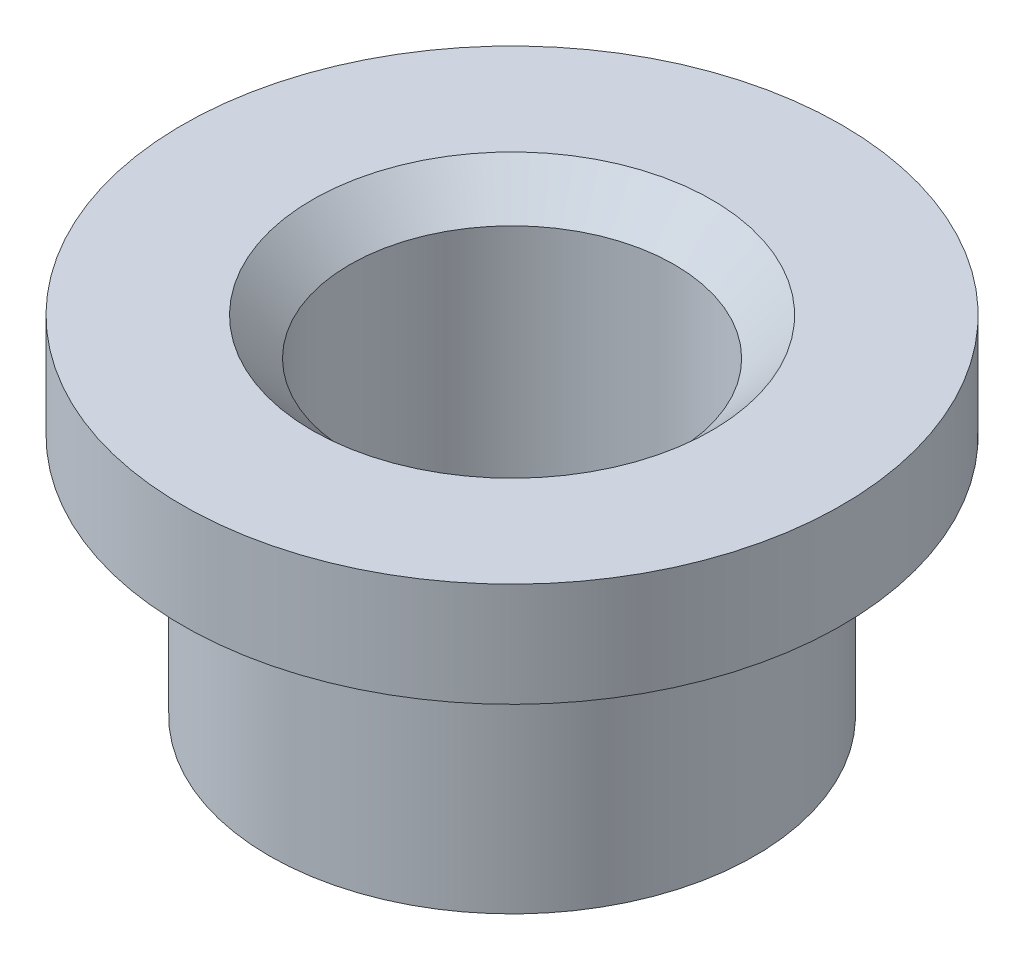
SolidWorks part; units mm, degrees
ref_plane "Front Plane" through (0, 0, 0) normal (0, 0, 1) x (1, 0, 0)
ref_plane "Top Plane" through (0, 0, 0) normal (0, 1, 0) x (1, 0, 0)
ref_plane "Right Plane" through (0, 0, 0) normal (1, 0, 0) x (0, 0, -1)
sketch "Sketch1" plane through (0, 0, 0) normal (0, 1, 0) x (1, 0, 0)
  circle A0 centre (0, 0) radius 12.065
  point P3 (0, 0)
extrude "Boss-Extrude1" add sketch "Sketch1" along normal blind 3.81
sketch "Sketch2" plane through (0, 0, 0) normal (0, -1, 0) x (1, 0, 0)
  circle A0 centre (0, 0) radius 8.89
extrude "Boss-Extrude2" add sketch "Sketch2" along normal blind 8.89
hole_wizard "1/4-18 NPSM Tapped Hole1" positions "3DSketch1" profile "Sketch3" tap size "1/4-18 NPSM" standard "ANSI Inch"
sketch3d "3DSketch1"
  point P0 (0, 0, 0)
  point P3 (0, 3.81, 0)
  point P6 (0, 0, 0)
  point P8 (0, 3.81, 0)
  point P10 (0, 3.81, 0)
  point P12 (0, 3.81, 0)
  point P13 (0.0126, 3.81, -0.019)
sketch "Sketch3" plane through (0, 3.81, 0) normal (1, 0, 0) x (0, 0, 1)
  line L0 (0, 0) -> (0, 12.7)
  line L1 (0, 12.7) -> (5.9436, 12.7)
  line L2 (5.9436, 12.7) -> (5.9436, 1.3716)
  line L3 (5.9436, 1.3716) -> (7.3152, 0)
  line L5 (7.3152, 0) -> (0, 0)
  line L6 (-5.9436, 1.3716) -> (-7.3152, 0) construction
  line L11 (0, -6.35) -> (0, 107.95) construction
  dimension "Thru Tap Drill Dia." = 11.8872
  dimension "Thru Tap Drill Depth" = 12.7
  dimension "Near C'Sink Dia." = 14.6304
  dimension "Near C'Sink Angle" = 90
